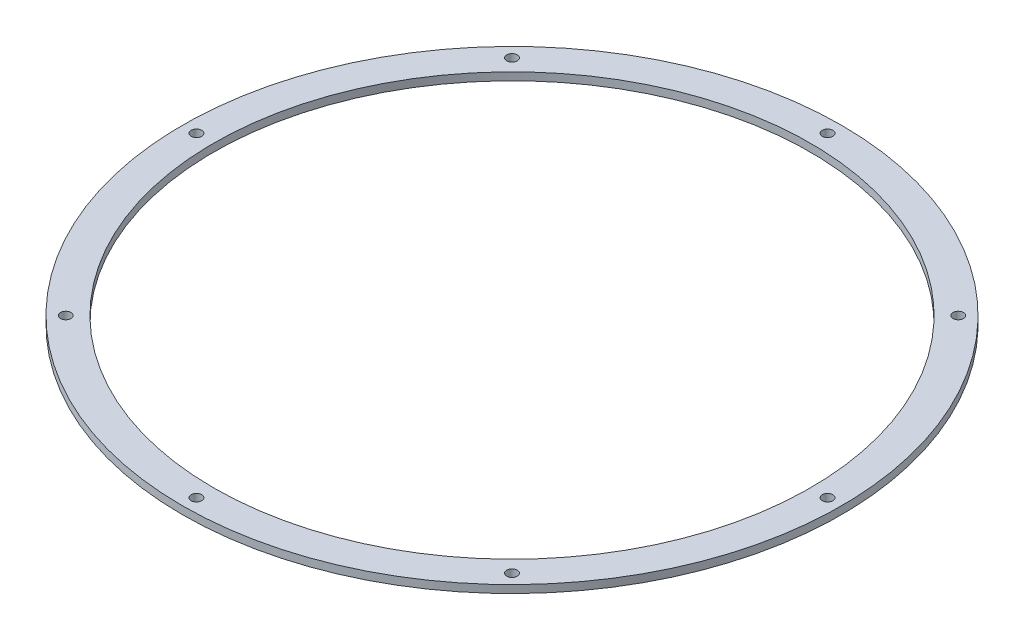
SolidWorks part; units mm, degrees
ref_plane "Front" through (0, 0, 0) normal (0, 0, 1) x (1, 0, 0)
ref_plane "Top" through (0, 0, 0) normal (0, 1, 0) x (1, 0, 0)
ref_plane "Right" through (0, 0, 0) normal (1, 0, 0) x (0, 0, -1)
sketch "Sketch1" plane through (0, 0, 0) normal (0, 1, 0) x (1, 0, 0)
  circle A0 centre (0, 0) radius 134.62
  circle A1 centre (0, 0) radius 121.92
  dimension "D1" = 269.24
  dimension "D2" = 243.84
extrude "Boss-Extrude1" add sketch "Sketch1" along normal blind 3.175
hole_wizard "M4 Clearance Hole1" positions "Sketch2" profile "Sketch3" hole size "M4" standard "ANSI Metric"
sketch "Sketch2" plane through (0, 3.175, 0) normal (0, 1, 0) x (1, 0, 0)
  point P0 (0, 128.905)
  dimension "D1" = 128.905
sketch "Sketch3" plane through (0, 3.175, -128.905) normal (1, 0, 0) x (0, 0, 1)
  line L0 (0, 0) -> (0, 3.175)
  line L1 (0, 3.175) -> (2.15, 3.175)
  line L2 (2.15, 3.175) -> (2.15, 0)
  line L5 (2.15, 0) -> (0, 0)
  line L11 (0, -6.35) -> (0, 107.95) construction
  dimension "Thru Hole Dia." = 4.3
  dimension "Thru Hole Depth" = 3.175
pattern_circular "CirPattern1" count 8 over 360 about axis through (0, 0, 0) along (0, 1, 0) of "M4 Clearance Hole1"
other "Freeze***"
